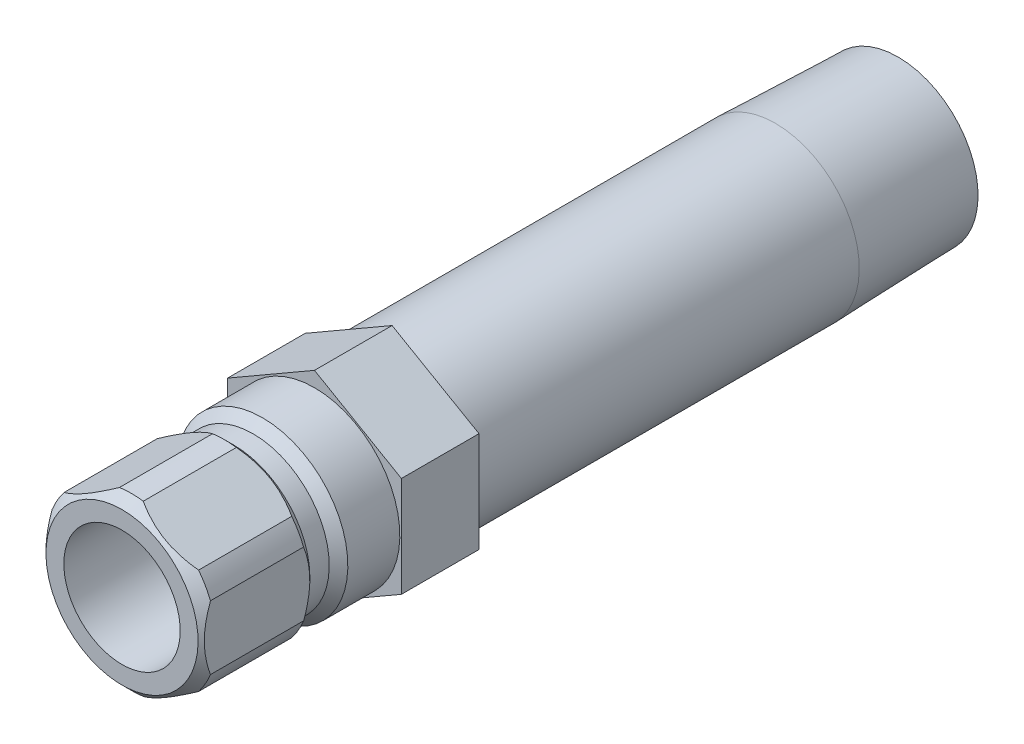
SolidWorks part; units mm, degrees
ref_plane "Front Plane" through (0, 0, 0) normal (0, 0, 1) x (1, 0, 0)
ref_plane "Top Plane" through (0, 0, 0) normal (0, 1, 0) x (1, 0, 0)
ref_plane "Right Plane" through (0, 0, 0) normal (1, 0, 0) x (0, 0, -1)
sketch "Sketch1" plane through (0, 0, 0) normal (1, 0, 0) x (0, 0, -1)
  line L0 (-12.8748, 0) -> (-18.923, 0) construction
  line L1 (-15.748, 4.7625) -> (-15.748, 6.223)
  line L2 (-6.604, 6.223) -> (-6.604, 0) construction
  line L3 (-14.986, 6.985) -> (-7.366, 6.985)
  line L4 (-3.556, 4.7625) -> (-3.556, 6.858) construction
  line L5 (-6.604, 6.223) -> (-5.0165, 6.223)
  line L6 (-4.2545, 6.985) -> (0, 6.985)
  line L7 (0, 6.985) -> (0, 6.858)
  line L8 (-6.604, 6.223) -> (-7.366, 6.985)
  line L9 (-5.0165, 6.223) -> (-4.2545, 6.985)
  line L10 (-15.748, 6.223) -> (-14.986, 6.985)
  line L11 (-15.748, 4.7625) -> (-3.556, 4.7625)
  line L12 (0, 6.858) -> (37.719, 6.858)
  line L13 (37.719, 6.858) -> (47.752, 6.5445)
  line L14 (47.752, 6.5445) -> (47.752, 4.6228)
  line L15 (-3.556, 4.7625) -> (-3.4817, 4.6228)
  line L16 (6.35, 6.858) -> (6.35, 0) construction
  line L17 (6.35, 0) -> (-12.8748, 0) construction
  line L19 (-3.4817, 4.6228) -> (47.752, 4.6228)
  dimension "D1" = 15.748
  dimension "D2" = 1.5875
  dimension "D3" = 0.762
  dimension "D4" = 45
  dimension "D5" = 9.144
  dimension "D6" = 45
  dimension "D7" = 1.79
  dimension "D8" = 10.033
  dimension "D9" = 63.5
  dimension "D10" = 3.175
  dimension "D11" = 9.525
  dimension "D12" = 13.716
  dimension "D13" = 22.098
  dimension "D14" = 13.97
  dimension "D15" = 9.2456
  dimension "D17" = 118
  dimension "D18" = 12.192
revolve "Revolve1" add sketch "Sketch1" angle 360 about L0
sketch "Sketch2" plane through (0, 0, 0) normal (0, 0, 1) x (1, 0, 0)
  line L1 (-7.112, 4.1061) -> (-7.112, -4.1061)
  line L2 (-7.112, -4.1061) -> (0, -8.2122)
  line L3 (0, -8.2122) -> (7.112, -4.1061)
  line L4 (7.112, -4.1061) -> (7.112, 4.1061)
  line L5 (7.112, 4.1061) -> (0, 8.2122)
  line L6 (0, 8.2122) -> (-7.112, 4.1061)
  circle A0 centre (0, 0) radius 7.112 construction
  circle A1 centre (0, 0) radius 4.6228 construction
  circle A2 centre (0, 0) radius 4.6228
  dimension "D1" = 14.224
extrude "Boss-Extrude1" add sketch "Sketch2" against normal up to vertex (6.35 mm away)
sketch "Sketch3" plane through (0, 0, 0) normal (0, 0, 1) x (1, 0, 0)
  line L1 (6.477, -3.7395) -> (6.477, 3.7395)
  line L2 (6.477, 3.7395) -> (0, 7.479)
  line L3 (0, 7.479) -> (-6.477, 3.7395)
  line L4 (-6.477, 3.7395) -> (-6.477, -3.7395)
  line L5 (-6.477, -3.7395) -> (0, -7.479)
  line L6 (0, -7.479) -> (6.477, -3.7395)
  circle A0 centre (0, 0) radius 6.477 construction
  dimension "D1" = 12.954
extrude "Cut-Extrude1" cut sketch "Sketch3" along normal through all from vertex at 6.604 flip side to cut
